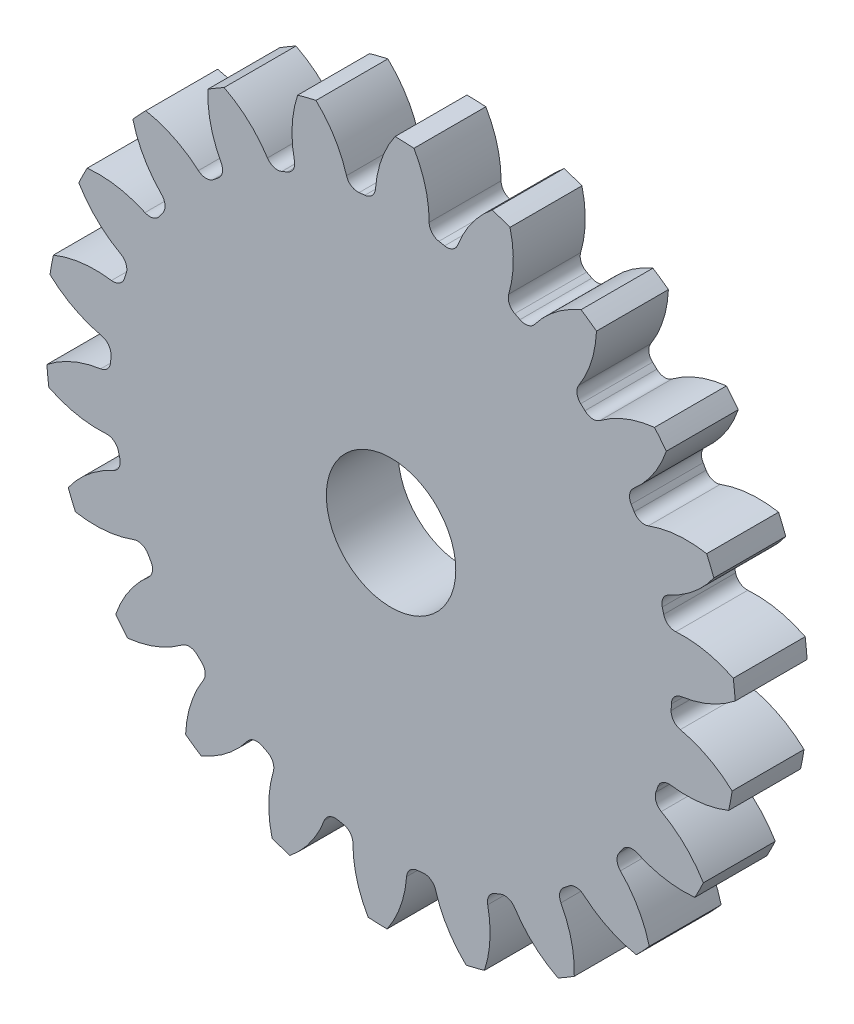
SolidWorks part; units mm, degrees
ref_plane "Front" through (0, 0, 0) normal (0, 0, 1) x (1, 0, 0)
ref_plane "Top" through (0, 0, 0) normal (0, 1, 0) x (1, 0, 0)
ref_plane "Right" through (0, 0, 0) normal (1, 0, 0) x (0, 0, -1)
sketch "Sketch3" plane through (0, 0, 0) normal (0, 0, 1) x (1, 0, 0)
  circle A0 centre (0, 0) radius 609.6
  dimension "od" = 1219.2
extrude "gearBody" add sketch "Sketch3" along normal blind 127
sketch "Sketch2" plane through (0, 0, 0) normal (0, 0, 1) x (1, 0, 0)
  line L0 (0, 0) -> (485.1294, 200.9472) construction
  line L1 (604.0084, -95.342) -> (0, 0) construction
  line L2 (0, 0) -> (36.3143, 0) construction
  line L3 (558.5127, 17.9157) -> (555.4199, -61.369) construction
  line L5 (556.9663, -21.7267) -> (0, 0) construction
  line L7 (0, 0) -> (525.1002, 0) construction
  arc A0 (525.0418, 7.8341) -> (522.836, -48.7108) centre (0, 0) ccw construction
  arc A1 (607.8187, 46.5679) -> (602.3441, -93.7751) centre (0, 0) ccw construction
  arc A2 (558.5127, 17.9157) -> (555.4199, -61.369) centre (0, 0) ccw construction
  arc A3 (494.6965, -24.4439) -> (495.0974, -14.1669) centre (0, 0) ccw
  arc A4 (604.0084, -95.342) -> (510.8538, -45.6458) centre (468.0015, -238.1278) ccw
  arc A5 (604.0084, -95.342) -> (609.6, 48.0004) centre (0, 0) ccw
  arc A6 (609.6, 48.0004) -> (512.8573, 5.7119) centre (485.1294, 200.9472) cw
  arc A7 (495.0974, -14.1669) -> (512.8573, 5.7119) centre (515.7645, -14.7583) cw
  arc A8 (510.8538, -45.6458) -> (494.6965, -24.4439) centre (515.3469, -25.4643) cw
  point P6 (609.6, 48.0004)
  point P22 (604.0084, -95.342)
  dimension "baseDia" = 1050.2005
  dimension "od" = 1219.2
  dimension "pd" = 1117.6
  dimension "rd" = 990.6
  dimension "rFillet" = 20.6756
  dimension "pointX" = 609.6
  dimension "pointY" = 48.0004
  dimension "CTT" = 79.2847
  dimension "flankCenterAngle" = 22.5
extrude "toothCut" cut sketch "Sketch2" along normal through all
pattern_circular "CirPattern1" count 22 over 360 about axis through (0, 0, 0) along (0, 0, 1) of "toothCut"
sketch "hub1Dia" plane through (0, 0, 0) normal (0, 0, -1) x (-1, 0, 0)
  circle A0 centre (0, 0) radius 12.7
  dimension "hub1Dia" = 25.4
sketch "hub2Dia" plane through (0, 0, 127) normal (0, 0, 1) x (1, 0, 0)
  circle A0 centre (0, 0) radius 12.7
  dimension "hub2dia" = 25.4
sketch "boreDia" plane through (0, 0, 0) normal (0, 0, 1) x (1, 0, 0)
  circle A0 centre (0, 0) radius 114.3
  dimension "boreDia" = 228.6
extrude "bore" cut sketch "boreDia" against normal mid plane 25400
